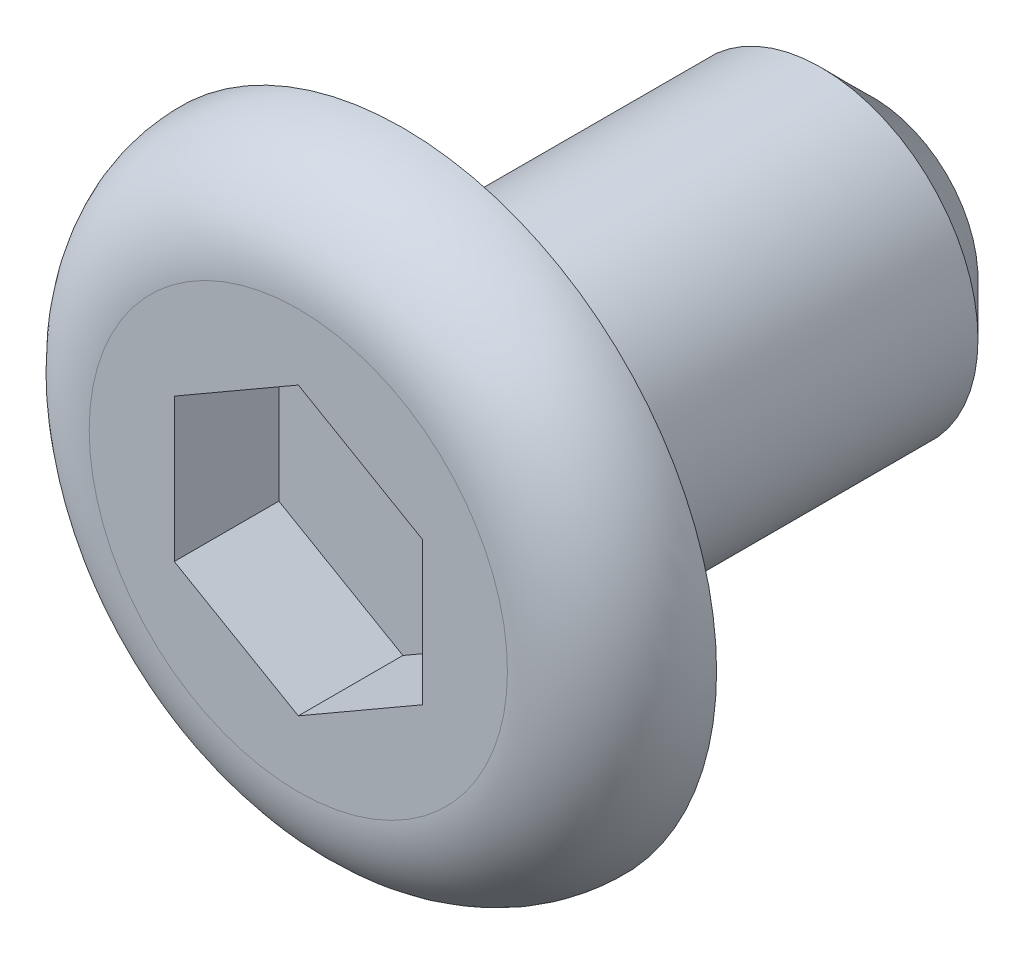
SolidWorks part; units mm, degrees
ref_plane "Front Plane" through (0, 0, 0) normal (0, 0, 1) x (1, 0, 0)
ref_plane "Top Plane" through (0, 0, 0) normal (0, 1, 0) x (1, 0, 0)
ref_plane "Right Plane" through (0, 0, 0) normal (1, 0, 0) x (0, 0, -1)
sketch "Sketch1" plane through (0, 0, 0) normal (0, 0, 1) x (1, 0, 0)
  circle A0 centre (-10.89, 115.0876) radius 3
  dimension "D1" = 6
extrude "Boss-Extrude1" add sketch "Sketch1" along normal blind 1
sketch "Sketch2" plane through (0, 0, 0) normal (0, 0, -1) x (-1, 0, 0)
  circle A0 centre (10.89, 115.0876) radius 1.5
  dimension "D1" = 3
extrude "Boss-Extrude2" add sketch "Sketch2" along normal blind 4.5
chamfer "Chamfer1" distance 0.5 angle 45 1 edges at (-12.39, 115.0876, -4.5)
sketch "Sketch3" plane through (0, 0, 1) normal (0, 0, 1) x (1, 0, 0)
  line L1 (-10.89, 113.7177) -> (-9.7036, 114.4027)
  line L2 (-9.7036, 114.4027) -> (-9.7036, 115.7726)
  line L3 (-9.7036, 115.7726) -> (-10.89, 116.4575)
  line L4 (-10.89, 116.4575) -> (-12.0764, 115.7726)
  line L5 (-12.0764, 115.7726) -> (-12.0764, 114.4027)
  line L6 (-12.0764, 114.4027) -> (-10.89, 113.7177)
  circle A0 centre (-10.89, 115.0876) radius 1.1864 construction
extrude "Cut-Extrude1" cut sketch "Sketch3" against normal blind 1
fillet "Fillet1" radius 1 1 edges at (-7.89, 115.0876, 1)
